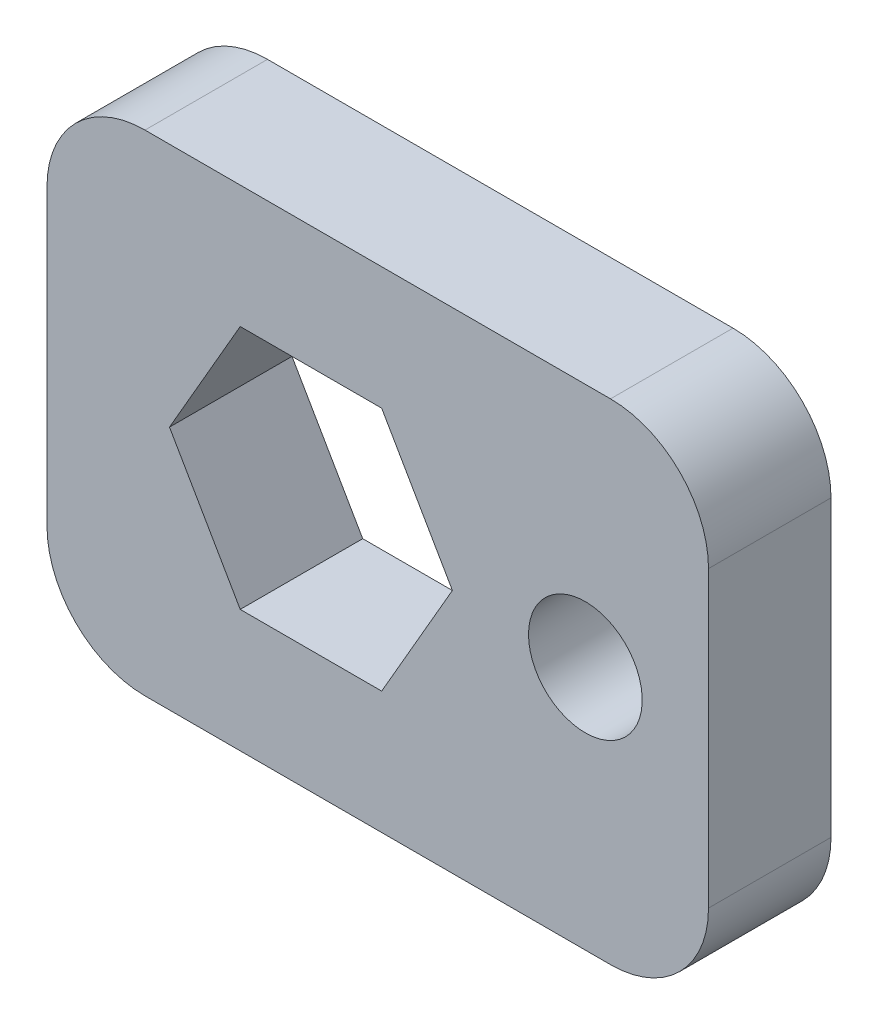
SolidWorks part; units mm, degrees
ref_plane "Front Plane" through (0, 0, 0) normal (0, 0, 1) x (1, 0, 0)
ref_plane "Top Plane" through (0, 0, 0) normal (0, 1, 0) x (1, 0, 0)
ref_plane "Right Plane" through (0, 0, 0) normal (1, 0, 0) x (0, 0, -1)
sketch "Sketch1" plane through (0, 0, 0) normal (0, 0, -1) x (-1, 0, 0)
  line L1 (0, 0) -> (17.145, 0)
  line L2 (0, 0) -> (0, 12.7)
  line L3 (0, 12.7) -> (17.145, 12.7)
  line L4 (17.145, 0) -> (17.145, 12.7)
  line L5 (13.97, 6.35) -> (12.1369, 9.525)
  line L6 (12.1369, 9.525) -> (8.4707, 9.525)
  line L7 (8.4707, 9.525) -> (6.6377, 6.35)
  line L8 (6.6377, 6.35) -> (8.4707, 3.175)
  line L9 (8.4707, 3.175) -> (12.1369, 3.175)
  line L10 (12.1369, 3.175) -> (13.97, 6.35)
  circle A1 centre (10.3038, 6.35) radius 3.175 construction
  point P8 (0, 6.35)
  dimension "D1" = 3.175
  dimension "D4" = 6.35
  dimension "D3" = 17.145
  dimension "D5" = 12.7
  dimension "D7" = 7.3323
extrude "Boss-Extrude1" add sketch "Sketch1" along normal blind 3.175
hole_wizard "#4 Clearance Hole1" positions "Sketch3" profile "Sketch2" hole size "#4" standard "ANSI Inch"
sketch "Sketch3" plane through (0, 0, -3.175) normal (0, 0, -1) x (-1, 0, 0)
  line L0 (0, 12.7) -> (0, 0) construction
  point P5 (3.1918, 6.35)
  dimension "D1" = 7.112
  dimension "D2" = 3.1918
sketch "Sketch2" plane through (-3.1918, 6.35, -3.175) normal (1, 0, 0) x (0, 1, 0)
  line L0 (0, 0) -> (0, 3.175)
  line L1 (0, 3.175) -> (1.4732, 3.175)
  line L2 (1.4732, 3.175) -> (1.4732, 0)
  line L5 (1.4732, 0) -> (0, 0)
  line L11 (0, -6.35) -> (0, 107.95) construction
  dimension "Thru Hole Dia." = 2.9464
  dimension "Thru Hole Depth" = 3.175
fillet "Fillet1" radius 2.54 4 edges at (-17.145, 0, -1.5875) (0, 0, -1.5875) (-17.145, 12.7, -1.5875) (0, 12.7, -1.5875)
sketch "Sketch4" plane through (0, 0, 0) normal (0, 0, 1) x (1, 0, 0)
  line L0 (-11.5593, 12.0974) -> (-11.5593, 0.6026) construction
  line L1 (-11.5593, 12.0974) -> (-17.2134, 17.2058)
  line L2 (-17.2134, -4.5058) -> (-11.5593, 0.6026)
  line L3 (-11.5593, 12.0974) -> (-15.9376, 9.2069)
  line L4 (-15.9376, 3.4931) -> (-11.5593, 0.6026)
  line L5 (-14.9649, 8.328) -> (-15.9376, 9.2069) construction
  line L6 (-15.9376, 3.4931) -> (-14.9649, 4.372) construction
  arc A0 (-15.9376, 9.2069) -> (-15.9376, 3.4931) centre (-5.198, 6.35) ccw
  arc A1 (-17.2134, 17.2058) -> (-17.2134, -4.5058) centre (-5.198, 6.35) ccw
  point P2 (-11.5593, 6.35)
  dimension "D2" = 7.62
  dimension "D1" = 5.08
extrude "Boss-Extrude2" [suppressed] add sketch "Sketch4" against normal blind 3.175
